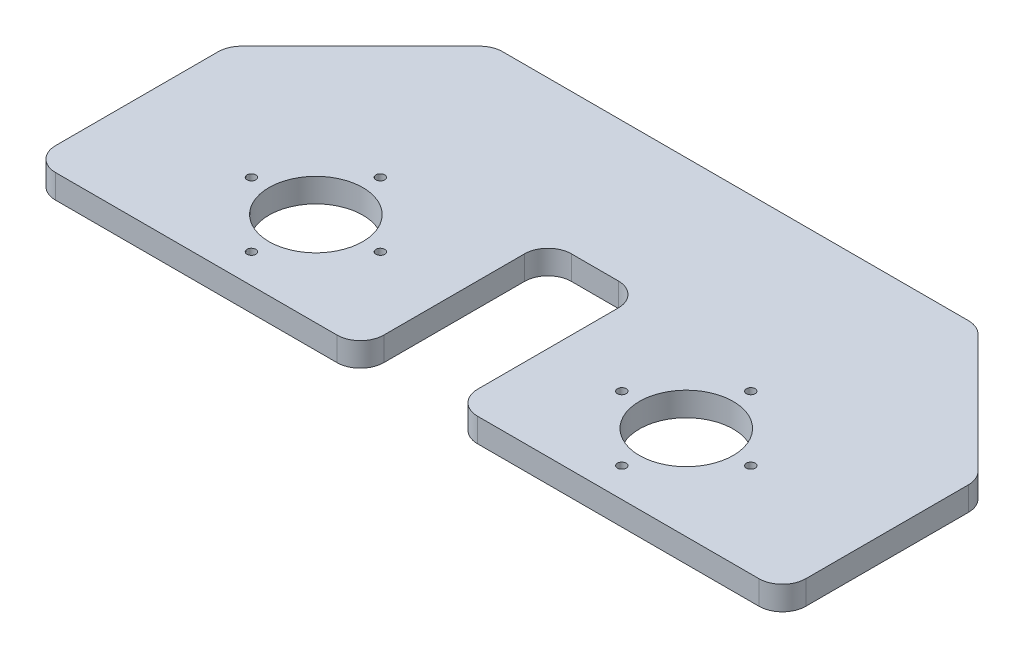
SolidWorks part; units mm, degrees
ref_plane "Front Plane" through (0, 0, 0) normal (0, 0, 1) x (1, 0, 0)
ref_plane "Top Plane" through (0, 0, 0) normal (0, 1, 0) x (1, 0, 0)
ref_plane "Right Plane" through (0, 0, 0) normal (1, 0, 0) x (0, 0, -1)
sketch "Sketch1" plane through (0, 0, 0) normal (0, 1, 0) x (1, 0, 0)
  line L0 (25.4, 50.8) -> (-25.4, -50.8) construction
  line L1 (-203.2, -50.8) -> (-25.4, -50.8)
  line L2 (-203.2, -50.8) -> (-203.2, 55.158)
  line L3 (-131.358, 127) -> (131.358, 127)
  line L4 (203.2, -50.8) -> (203.2, 55.158)
  line L5 (-131.358, 127) -> (-203.2, 55.158)
  line L6 (-25.4, -50.8) -> (-25.4, 50.8)
  line L7 (-25.4, 50.8) -> (25.4, 50.8)
  line L8 (25.4, -50.8) -> (25.4, 50.8)
  line L9 (25.4, -50.8) -> (203.2, -50.8)
  line L10 (131.358, 127) -> (203.2, 55.158)
  dimension "D1" = 406.4
  dimension "D2" = 203.2
  dimension "D3" = 177.8
  dimension "D4" = 127
  dimension "D5" = 50.8
  dimension "D6" = 101.6
  dimension "D7" = 101.6
  dimension "D8" = 135
  dimension "D9" = 45
extrude "Boss-Extrude1" add sketch "Sketch1" against normal blind 12.954
sketch "Sketch2" plane through (0, 0, 0) normal (0, 1, 0) x (1, 0, 0)
  circle A0 centre (-100.33, 0) radius 25.4
  circle A1 centre (100.33, 0) radius 25.4
  dimension "D1" = 50.8
  dimension "D2" = 50.8
  dimension "D3" = 100.33
  dimension "D4" = 100.33
extrude "Cut-Extrude1" cut sketch "Sketch2" against normal through all
sketch "Sketch3" plane through (0, 0, 0) normal (0, 1, 0) x (1, 0, 0)
  circle A0 centre (-100.33, 34.925) radius 2.3749
  circle A1 centre (-100.33, -34.925) radius 2.3749
  circle A2 centre (-65.405, 0) radius 2.3749
  circle A3 centre (-135.255, 0) radius 2.3749
  circle A4 centre (65.405, 0) radius 2.3749
  circle A5 centre (100.33, 34.925) radius 2.3749
  circle A6 centre (135.255, 0) radius 2.3749
  circle A7 centre (100.33, -34.925) radius 2.3749
  circle A8 centre (-100.33, 0) radius 25.4 construction
  circle A9 centre (100.33, 0) radius 25.4 construction
  dimension "D3" = 34.925
  dimension "D4" = 34.925
  dimension "D5" = 34.925
  dimension "D6" = 34.925
  dimension "D7" = 4.7498
  dimension "D8" = 4.7498
  dimension "D9" = 4.7498
  dimension "D10" = 4.7498
  dimension "D11" = 4.7498
  dimension "D12" = 4.7498
  dimension "D13" = 4.7498
  dimension "D14" = 4.7498
  dimension "D1" = 34.925
  dimension "D2" = 34.925
extrude "Cut-Extrude2" cut sketch "Sketch3" against normal blind 6.35
fillet "Fillet1" radius 12.7 10 edges at (-203.2, -6.477, 50.8) (-25.4, -6.477, -50.8) (25.4, -6.477, -50.8) (25.4, -6.477, 50.8) (-25.4, -6.477, 50.8) (203.2, -6.477, 50.8) (203.2, -6.477, -55.158) (131.358, -6.477, -127) (-131.358, -6.477, -127) (-203.2, -6.477, -55.158)
